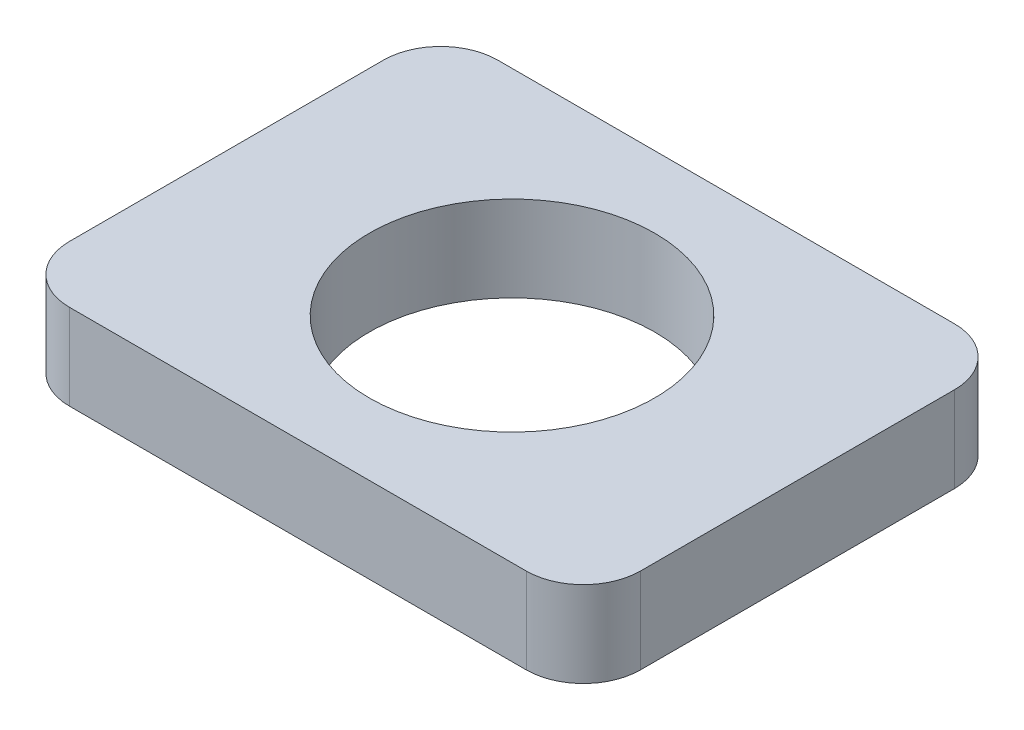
SolidWorks part; units mm, degrees
ref_plane "Front Plane" through (0, 0, 0) normal (0, 0, 1) x (1, 0, 0)
ref_plane "Top Plane" through (0, 0, 0) normal (0, 1, 0) x (1, 0, 0)
ref_plane "Right Plane" through (0, 0, 0) normal (1, 0, 0) x (0, 0, -1)
sketch "Sketch1" plane through (0, 0, 0) normal (0, 1, 0) x (1, 0, 0)
  line L1 (-10, -7.5) -> (10, -7.5)
  line L2 (-10, -7.5) -> (-10, 7.5)
  line L3 (-10, 7.5) -> (10, 7.5)
  line L4 (10, -7.5) -> (10, 7.5)
  line L5 (-10, -7.5) -> (10, 7.5) construction
  line L6 (-10, 7.5) -> (10, -7.5) construction
  circle A0 centre (0, 0) radius 5
extrude "Boss-Extrude1" add sketch "Sketch1" along normal blind 3
fillet "Fillet1" radius 2 4 edges at (-10, 1.5, 7.5) (-10, 1.5, -7.5) (10, 1.5, -7.5) (10, 1.5, 7.5)
